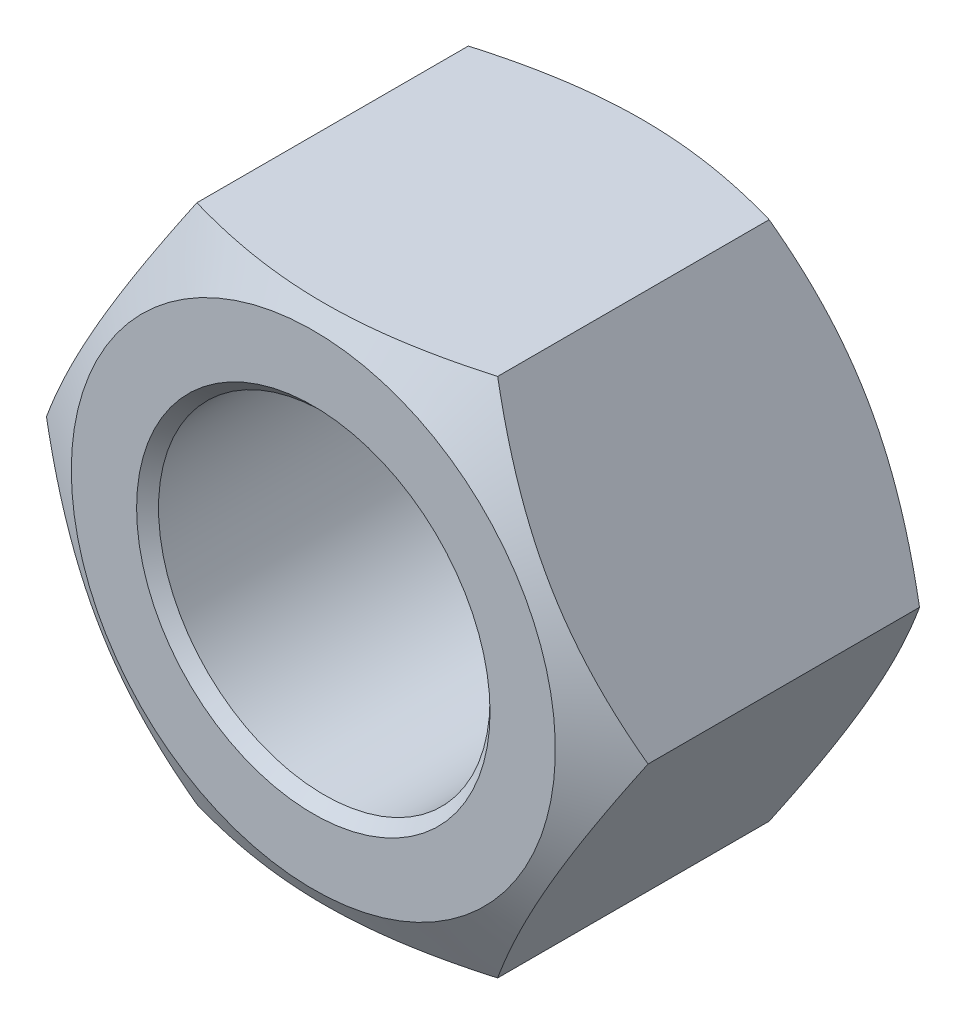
SolidWorks part; units mm, degrees
ref_plane "Front" through (0, 0, 0) normal (0, 0, 1) x (1, 0, 0)
ref_plane "Top" through (0, 0, 0) normal (0, 1, 0) x (1, 0, 0)
ref_plane "Right" through (0, 0, 0) normal (1, 0, 0) x (0, 0, -1)
sketch "Sketch1" plane through (0, 0, 0) normal (0, 0, 1) x (1, 0, 0)
  line L1 (15.8771, -27.5) -> (31.7543, 0)
  line L2 (31.7543, 0) -> (15.8771, 27.5)
  line L3 (15.8771, 27.5) -> (-15.8771, 27.5)
  line L4 (-15.8771, 27.5) -> (-31.7543, 0)
  line L5 (-31.7543, 0) -> (-15.8771, -27.5)
  line L6 (-15.8771, -27.5) -> (15.8771, -27.5)
  circle A0 centre (0, 0) radius 27.5 construction
  circle A1 centre (0, 0) radius 17.5
  dimension "D1" = 35
  dimension "s" = 55
extrude "BaseNut" add sketch "Sketch1" against normal blind 34.7
sketch "Sketch2" plane through (15.0481, 0, -16.7061) normal (0, 1, 0) x (0, 0, -1)
  line L0 (-23.7227, 15.0481) -> (22.0646, 15.0481) construction
  line L2 (17.9939, 46.8024) -> (17.9939, 30.9252) construction
  line L4 (17.9939, 46.8024) -> (-16.7061, 46.8024) construction
  line L8 (15.5376, 46.8024) -> (17.9939, 42.5481)
  line L9 (17.9939, 46.8024) -> (15.5376, 46.8024)
  line L10 (17.9939, 42.5481) -> (17.9939, 46.8024)
  dimension "D1" = 30
  dimension "s1" = 55
revolve "Chamfer1" cut sketch "Sketch2" angle 360 about L0
sketch "Sketch6" plane through (-9.1975, 0, -10.2525) normal (0, 1, 0) x (0, 0, 1)
  line L0 (23.3574, 9.1975) -> (-22.3023, 9.1975) construction
  line L2 (-24.4475, 26.6975) -> (-24.4475, 28.6475)
  line L4 (-24.4475, 28.6475) -> (-23.3216, 26.6975)
  line L6 (-23.3216, 26.6975) -> (-24.4475, 26.6975)
  dimension "da" = 38.9
  dimension "D2" = 60
revolve "EndChamfer1" cut sketch "Sketch6" angle 360 about L0
sketch "Sketch5" plane through (-14.793, 0, -16.9612) normal (0, 1, 0) x (0, 0, 1)
  line L0 (-22.5748, 14.793) -> (24.743, 14.793) construction
  line L2 (16.9612, 40.343) -> (16.9612, 46.5473)
  line L4 (16.9612, 46.5473) -> (13.3792, 46.5473)
  line L6 (13.3792, 46.5473) -> (16.9612, 40.343)
  dimension "dw1" = 51.1
  dimension "D2" = 30
revolve "Chamfer2" cut sketch "Sketch5" angle 360 about L0
sketch "Sketch3" plane through (-20.9491, 1.8856, 0) normal (0, 0, 1) x (1, 0, 0)
  circle A1 centre (20.9491, -1.8856) radius 17.5 construction
  circle A2 centre (20.9491, -1.8856) radius 25.55
  circle A3 centre (20.9491, -1.8856) radius 17.5
  dimension "dw" = 51.1
extrude "Extrude1" [suppressed] add sketch "Sketch3" along normal blind 0.8
chamfer "EndChamfer3" [suppressed] distance 1.1567 angle 45
chamfer "EndChamfer2" distance 1.1567 angle 45 1 edges at (17.5, 0, 0)
sketch "Sketch7" plane through (0, 0, 0) normal (0, 1, 0) x (1, 0, 0)
  line L0 (0, 48.6183) -> (0, -13.0076) construction
  line L1 (16.5, 34.0742) -> (17.5, 34.0742)
  line L2 (17.5, 34.0742) -> (18.366, 33.5742)
  line L3 (18.366, 33.5742) -> (17.5, 33.0742)
  line L4 (17.5, 33.0742) -> (16.5, 33.0742)
  line L5 (16.5, 33.0742) -> (16.5, 34.0742)
  line L6 (17.5, 33.5742) -> (-17.5, 33.5742) construction
  dimension "D1" = 1
  dimension "D2" = 35
revolve "Cut-Revolve10" [suppressed] cut sketch "Sketch7" angle 360 about L0
pattern_linear "LPattern10" [suppressed] count 28 spacing 1.2 along (0, 0, -1)
equation "\"D1@EndChamfer3\" = \"m@BaseNut\" / 30"
equation "\"D1@EndChamfer2\" = \"m@BaseNut\" / 30"
equation "\"s1@Sketch2\" = \"s@Sketch1\""
equation "\"D2@Sketch7\" = \"D1@Sketch1\""
equation "\"D1@Sketch7\" = (  \"D2@ThreadCosmetic1\" - \"D1@Sketch1\" )  / 2"
equation "\"D3@LPattern10\" = \"D1@Sketch7\" * 1.2"
equation "\"D1@LPattern10\" = \"m@BaseNut\" / \"D3@LPattern10\" - 1"
